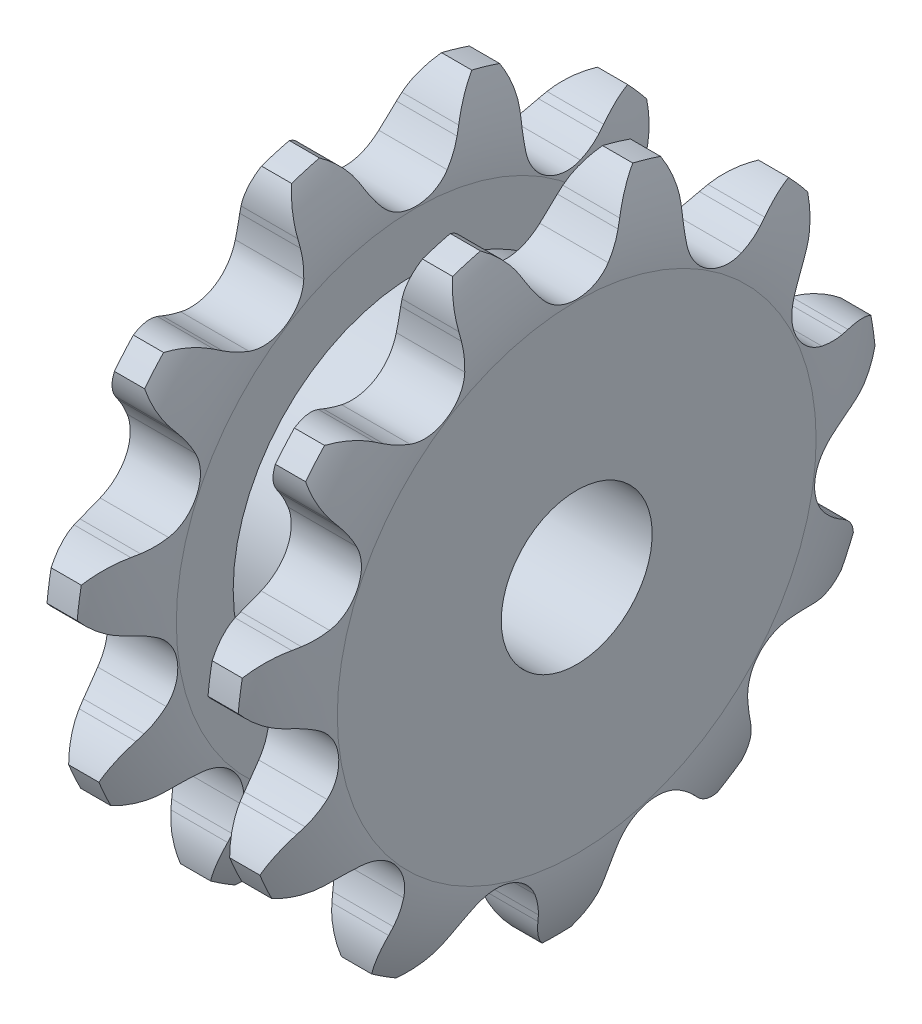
SolidWorks part; units mm, degrees
ref_plane "Plane1" through (0, 0, 0) normal (0, 0, 1) x (1, 0, 0)
ref_plane "Plane2" through (0, 0, 0) normal (0, 1, 0) x (1, 0, 0)
ref_plane "Plane3" through (0, 0, 0) normal (1, 0, 0) x (0, 0, -1)
sketch "Clipboard" plane through (0, 0, 0) normal (0, 1, 0) x (1, 0, 0)
  line L0 (0, 0) -> (6.2333, -1.2116)
  line L1 (-15, 0) -> (100, 0) construction
  line L2 (0, 0) -> (-0.5301, 0.5991)
  line L3 (0, 0) -> (-2.9891, 1.1425)
  line L4 (0, 0) -> (3.043, 0.5915)
  line L5 (0, 0) -> (-89.0105, -33.1983)
  line L6 (0, 0) -> (-7.6265, -5.1456)
  line L7 (-0.5301, 0.5991) -> (92.0355, 21.9696)
  line L8 (-76.2, 38.1) -> (-75.2, 38.1)
  line L9 (-73.2358, 39.4872) -> (-73.0836, 39.4947)
  line L10 (-73.0533, 76.1892) -> (-66.6533, 76.1892)
  circle A0 centre (0, 0) radius 1.651
  circle A1 centre (0, 0) radius 4
  circle A2 centre (0, 0) radius 4
  dimension "Dr" = 3.302
  dimension "MHD" = 8
  dimension "Hub_dia" = 8
  dimension "Num_teeth" = 11
  dimension "Pitch" = 6.35
  dimension "Width" = 3.1
  dimension "Chamfer_wid" = 0.8
  dimension "Chamfer_dep" = 3.2
  dimension "Overall_len" = 95
  dimension "Show_teeth" = 11
  dimension "Thickness" = 9.2
  dimension "OAL" = 95.0005
  dimension "T_dim" = 1
  dimension "Width_const_x" = 0.1524
  dimension "Face_width" = 2.8
  dimension "Num_strands" = 2
  dimension "Transv_pitch" = 6.4
sketch "BasProSke" plane through (0, 0, 0) normal (0, 1, 0) x (1, 0, 0)
  line L0 (-10, 0) -> (60, 0) construction
  line L1 (0, 0) -> (0, 9.5181)
  line L2 (0, 0) -> (9.2, 0)
  line L3 (9.2, 0) -> (9.2, 9.5181)
  line L4 (8.4, 12.7181) -> (0.8, 12.7181)
  arc A0 (0, 9.5181) -> (0.8, 12.7181) centre (6.8, 9.5181) cw
  arc A1 (9.2, 9.5181) -> (8.4, 12.7181) centre (2.4, 9.5181) ccw
  dimension "D1" = 6.8
  dimension "G1" = 0.8
  dimension "G2" = 0.8
  dimension "H2" = 3.2
  dimension "Diameter" = 25.4361
  dimension "H1" = 3.2
  dimension "Thickness" = 9.2
revolve "Base-Revolve" add sketch "BasProSke" angle 360 about L0
sketch "GrvSke" plane through (0, 0, 0) normal (0, 1, 0) x (1, 0, 0)
  line L0 (2.8, 9.5181) -> (2.8, 7.2571)
  line L1 (2.8, 7.2571) -> (6.4, 7.2571)
  line L2 (6.4, 7.2571) -> (6.4, 9.5181)
  line L3 (2, 12.7181) -> (7.2, 12.7181)
  line L4 (4.6, 0) -> (4.6, 52.07) construction
  line L5 (-10, 0) -> (60, 0) construction
  line L6 (0, 0) -> (35.56, 0) construction
  arc A0 (6.4, 9.5181) -> (7.2, 12.7181) centre (13.2, 9.5181) cw
  arc A1 (2.8, 9.5181) -> (2, 12.7181) centre (-4, 9.5181) ccw
  dimension "Diameter" = 25.4361
  dimension "H1" = 3.2
  dimension "Grv_diam" = 14.5141
  dimension "Grv_width" = 3.6
  dimension "Offset" = 4.6
  dimension "G1" = 0.8
revolve "Groove" cut sketch "GrvSke" angle 360 about L6
pattern_linear "Grooves" [suppressed]
sketch "TooCutSke" plane through (0, 0, 0) normal (1, 0, 0) x (0, 0, -1)
  line L0 (1.8371, 10.977) -> (1.9787, 11.2486)
  line L1 (0, 0) -> (0, 107) construction
  line L2 (0, 11.2696) -> (-10, 11.2696) construction
  line L3 (-1.8371, 10.977) -> (-1.9787, 11.2486)
  arc A0 (1.2916, 10.1682) -> (1.8371, 10.977) centre (-2.01, 12.9835) ccw
  arc A1 (1.2916, 10.1682) -> (-1.2916, 10.1682) centre (0, 11.2696) cw
  arc A2 (1.9787, 11.2486) -> (4.4355, 12.7381) centre (4.4355, 9.9672) cw
  arc A3 (-1.2916, 10.1682) -> (-1.8371, 10.977) centre (2.01, 12.9835) cw
  arc A4 (-1.9787, 11.2486) -> (-4.4355, 12.7381) centre (-4.4355, 9.9672) ccw
  arc A5 (4.4355, 12.7381) -> (-4.4355, 12.7381) centre (0, 0) ccw
  dimension "R" = 1.6974
  dimension "E" = 4.339
  dimension "F" = 2.7709
  dimension "Pitch_radius" = 11.2696
  dimension "W" = 4.4355
  dimension "V" = 1.3024
  dimension "A" = 40.455
  dimension "B" = 12.909
extrude "ToothCut" cut sketch "TooCutSke" along normal through all
pattern_circular "TeethCuts" count 11 every 32.727 about axis through (-10, 0, 0) along (1, 0, 0) of "ToothCut"
sketch "HubNeaOneSke" plane through (0, 0, 0) normal (-1, 0, 0) x (0, 0, 1)
  circle A0 centre (0, 0) radius 4
  dimension "Diameter" = 8
extrude "HubNearOne" [suppressed] add sketch "HubNeaOneSke" along normal blind 85.8005
sketch "HubNeaBotSke" plane through (0, 0, 0) normal (-1, 0, 0) x (0, 0, 1)
  circle A0 centre (0, 0) radius 4
  dimension "Diameter" = 8
extrude "HubNearBoth" [suppressed] add sketch "HubNeaBotSke" along normal blind 42.9002
ref_plane "FarPln" through (9.2, 0, 0) normal (1, 0, 0) x (0, 0, -1)
sketch "HubFarSke" plane through (9.2, 0, 0) normal (1, 0, 0) x (0, 0, -1)
  circle A0 centre (0, 0) radius 4
  dimension "Diameter" = 8
extrude "HubFar" [suppressed] add sketch "HubFarSke" along normal blind 42.9002
sketch "BorSke" plane through (0, 0, 0) normal (1, 0, 0) x (0, 0, -1)
  circle A0 centre (0, 0) radius 3
  dimension "Diameter" = 6
extrude "Bore" cut sketch "BorSke" along normal mid plane 190.001
sketch "KeySke" plane through (0, 0, 0) normal (1, 0, 0) x (0, 0, -1)
  line L0 (-1, 0) -> (-1, 4)
  line L1 (-1, 4) -> (1, 4)
  line L2 (1, 4) -> (1, 0)
  line L3 (0, 0) -> (0, 34) construction
  line L4 (-1, 0) -> (1, 0)
  dimension "Offset" = 4
  dimension "Width" = 2
extrude "Keyway" [suppressed] cut sketch "KeySke" along normal mid plane 190.001
pattern_circular "Keyway2" [suppressed] count 2 every 90 about axis through (-10, 0, 0) along (1, 0, 0)
equation "' \"Pitch@Clipboard\" = 6.35"
equation "' \"Num_strands@Clipboard\" = 2"
equation "' \"Num_teeth@Clipboard\" = 11"
equation "' \"Hub_dia@Clipboard\" = 8"
equation "' \"Overall_len@Clipboard\" = 95"
equation "' \"Diameter@BorSke\" = 6"
equation "' \"T_dim@Clipboard\" = 1"
equation "' \"Width@KeySke\" = 2"
equation "' \"Dr@Clipboard\" = 3.302"
equation "' \"Face_width@Clipboard\" = 2.8"
equation "' \"Chamfer_dep@Clipboard\" = 3.2"
equation "' \"Chamfer_wid@Clipboard\" = 0.8"
equation "' \"Transv_pitch@Clipboard\" = 6.4"
equation "' \"Show_teeth@Clipboard\" = 11"
equation "\"Num_teeth@Clipboard\" = int( \"Num_teeth@Clipboard\" )"
equation "\"Num_teeth@Clipboard\" = ((sgn( \"Num_teeth@Clipboard\" - 5.0)+1)*( \"Num_teeth@Clipboard\" - 5.0))/2 +5.0"
equation "\"Num_teeth@Clipboard\" = ((sgn( \"Num_teeth@Clipboard\" - 200.0)-1)*( \"Num_teeth@Clipboard\" - 200.0))/-2 +200.0"
equation "\"MHD@Clipboard\" = \"Pitch@Clipboard\" * (1.0 / tan(3.14159265 / \"Num_teeth@Clipboard\" ) - 1.0) - 0.762"
equation "\"Thickness@Clipboard\"  = \"Face_width@Clipboard\" + (\"Num_strands@Clipboard\" - 1) * \"Transv_pitch@Clipboard\""
equation "\"OAL@Clipboard\" = \"Thickness@Clipboard\""
equation "\"MHD@Clipboard\" = ((sgn( \"MHD@Clipboard\" - \"Hub_dia@Clipboard\" )-1)*( \"MHD@Clipboard\" - \"Hub_dia@Clipboard\" ))/-2+ \"Hub_dia@Clipboard\""
equation "\"OAL@Clipboard\" = ((sgn( \"OAL@Clipboard\" - \"Overall_len@Clipboard\" )+1)*( \"OAL@Clipboard\" - \"Overall_len@Clipboard\" ))/2 + \"Overall_len@Clipboard\" + 0.0005"
equation "\"Num_teeth@TeethCuts\" = int( \"Show_teeth@Clipboard\" ) + 1"
equation "\"Num_teeth@TeethCuts\" = ((sgn( \"Num_teeth@TeethCuts\" - \"Num_teeth@Clipboard\" )-1)*( \"Num_teeth@TeethCuts\" - \"Num_teeth@Clipboard\" ))/-2+ \"Num_teeth@Clipboard\""
equation "\"Num_teeth@TeethCuts\" = ((sgn( \"Num_teeth@TeethCuts\" - 2.0)+1)*( \"Num_teeth@TeethCuts\" - 2.0))/2 +2.0"
equation "\"Angle@TeethCuts\" = 360.0 / \"Num_teeth@Clipboard\""
equation "\"Pitch_radius@TooCutSke\" = ( \"Pitch@Clipboard\" / 2.0) / sin(3.14159265 / \"Num_teeth@Clipboard\" )  'ma"
equation "\"R@TooCutSke\"  = \"Dr@Clipboard\" * 0.5025 + 0.0381"
equation "\"A@TooCutSke\" = 35.0 + (60.0 / \"Num_teeth@Clipboard\")"
equation "\"E@TooCutSke\"  = \"Dr@Clipboard\" * 1.3025 + 0.0381"
equation "\"B@TooCutSke\"  = 18.0 - (56.0 / \"Num_teeth@Clipboard\" )"
equation "\"W@TooCutSke\" = 1.4 * \"Dr@Clipboard\" * cos(3.14159265 / \"Num_teeth@Clipboard\" )"
equation "\"V@TooCutSke\" = 1.4 * \"Dr@Clipboard\" * sin(3.14159265 / \"Num_teeth@Clipboard\" )"
equation "\"Diameter@BasProSke\" = 2.0 * ( (0.3 * \"Pitch@Clipboard\" ) +  \"Pitch@Clipboard\" / 2.0 / tan(3.14159265 / \"Num_teeth@Clipboard\" ))"
equation "\"Thickness@BasProSke\"  = \"Thickness@Clipboard\""
equation "\"G1@BasProSke\" =  \"Chamfer_wid@Clipboard\""
equation "\"G2@BasProSke\" =  \"Chamfer_wid@Clipboard\""
equation "\"H1@BasProSke\" =  \"Chamfer_dep@Clipboard\""
equation "\"H2@BasProSke\" =  \"Chamfer_dep@Clipboard\""
equation "\"Diameter@GrvSke\" = \"Diameter@BasProSke\""
equation "\"G1@GrvSke\" = \"Chamfer_wid@Clipboard\""
equation "\"H1@GrvSke\" = \"Chamfer_dep@Clipboard\""
equation "\"Grv_diam@GrvSke\" =  \"Pitch@Clipboard\" * (1.0 / tan(3.14159265 / \"Num_teeth@Clipboard\" ) - 1.0) - 0.762"
equation "\"Grv_width@GrvSke\" =  \"Transv_pitch@Clipboard\" - \"Face_width@Clipboard\""
equation "\"Offset@GrvSke\" = \"Grv_width@GrvSke\" / 2.0 + \"Face_width@Clipboard\""
equation "\"Offset@Grooves\" = \"Transv_pitch@Clipboard\""
equation "\"Num_grvs@Grooves\" = \"Num_strands@Clipboard\""
equation "\"Num_grvs@Grooves\" = \"Num_grvs@Grooves\" - 1 * sgn( \"Num_grvs@Grooves\" -1)"
equation "\"Diameter@HubNeaOneSke\" = \"MHD@Clipboard\""
equation "\"Length@HubNearOne\" = \"OAL@Clipboard\" - \"Thickness@BasProSke\""
equation "\"Diameter@HubNeaBotSke\" = \"MHD@Clipboard\""
equation "\"Length@HubNearBoth\" = ( \"OAL@Clipboard\" - \"Thickness@BasProSke\" ) / 2.0"
equation "\"Thickness@FarPln\" = \"Thickness@BasProSke\""
equation "\"Diameter@HubFarSke\" = \"MHD@Clipboard\""
equation "\"Length@HubFar\" = ( \"OAL@Clipboard\" - \"Thickness@BasProSke\" ) / 2.0"
equation "\"D1@Bore\" = \"OAL@Clipboard\" * 2.0"
equation "\"D1@Keyway\" = \"OAL@Clipboard\" * 2.0"
equation "\"Offset@KeySke\" = \"T_dim@Clipboard\" + \"Diameter@BorSke\" / 2.0"
